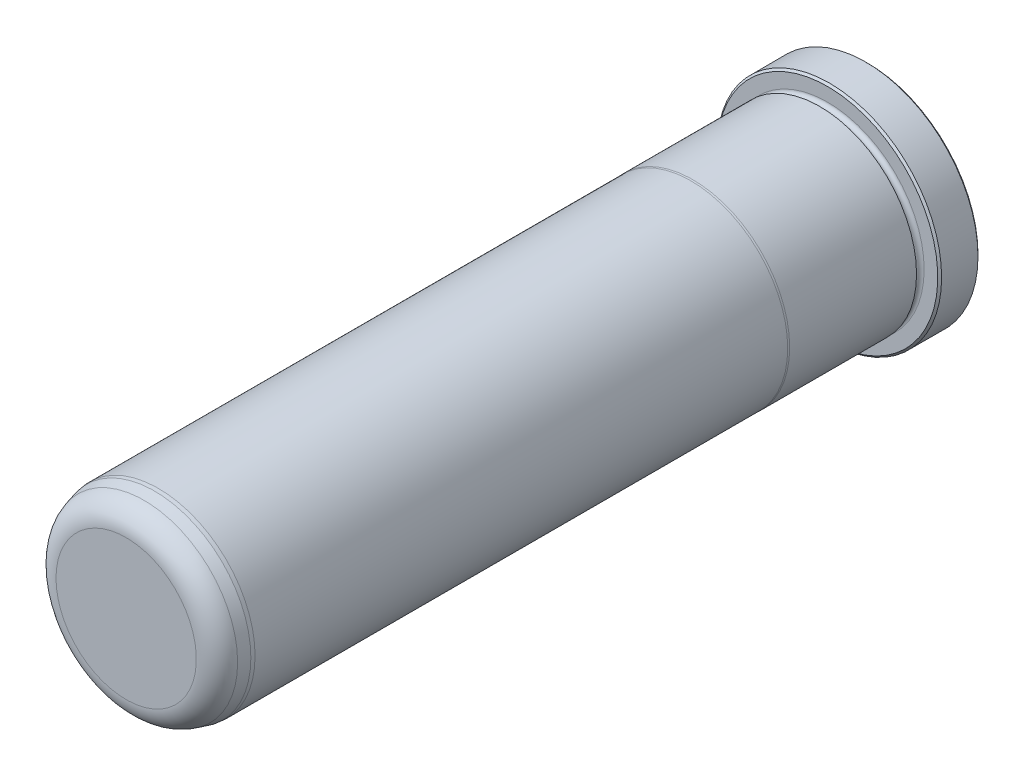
SolidWorks part; units mm, degrees
ref_plane "Front Plane" through (0, 0, 0) normal (0, 0, 1) x (1, 0, 0)
ref_plane "Top Plane" through (0, 0, 0) normal (0, 1, 0) x (1, 0, 0)
ref_plane "Right Plane" through (0, 0, 0) normal (1, 0, 0) x (0, 0, -1)
sketch "Sketch1" plane through (0, 0, 0) normal (1, 0, 0) x (0, 0, -1)
  line L0 (0, 0) -> (0, 22.098)
  line L1 (0, 22.098) -> (-7.9248, 22.098)
  line L2 (-7.9248, 22.098) -> (-7.9248, 19.0373)
  line L3 (-7.9248, 18.2753) -> (-9.4488, 18.2753) construction
  line L4 (-9.4488, 19.0373) -> (-9.4488, 19.0627)
  line L5 (-9.4488, 19.0627) -> (-34.4348, 19.0627)
  line L6 (-34.4348, 19.0627) -> (-34.798, 19.0373)
  line L7 (-34.798, 19.0373) -> (-139.7, 19.0373)
  line L9 (-146.05, 17.4733) -> (-146.05, 0)
  line L10 (-146.05, 0) -> (0, 0)
  line L11 (0, 0) -> (13.6287, 0) construction
  line L12 (-139.7, 19.0373) -> (-140.462, 18.9706)
  line L13 (-140.462, 18.9706) -> (-146.05, 17.4733)
  arc A0 (-9.4488, 19.0373) -> (-7.9248, 19.0373) centre (-8.6868, 19.0373) ccw
  dimension "D14" = 1.524
  dimension "D1" = 7.9248
  dimension "D2" = 1.524
  dimension "D3" = 44.196
  dimension "D4" = 38.1254
  dimension "D5" = 34.798
  dimension "D6" = 146.05
  dimension "D7" = 0.7874
  dimension "D8" = 4
  dimension "D9" = 38.0746
  dimension "D10" = 5
  dimension "D11" = 15
  dimension "D12" = 0.762
  dimension "D13" = 6.35
revolve "Revolve1" add sketch "Sketch1" angle 360 about L11
fillet "Fillet6" radius 4.7625 1 edges at (17.4733, 0, 146.05)
chamfer "Chamfer1" distance 0.381 angle 45 2 edges at (22.098, 0, 0) (22.098, 0, 7.9248)
